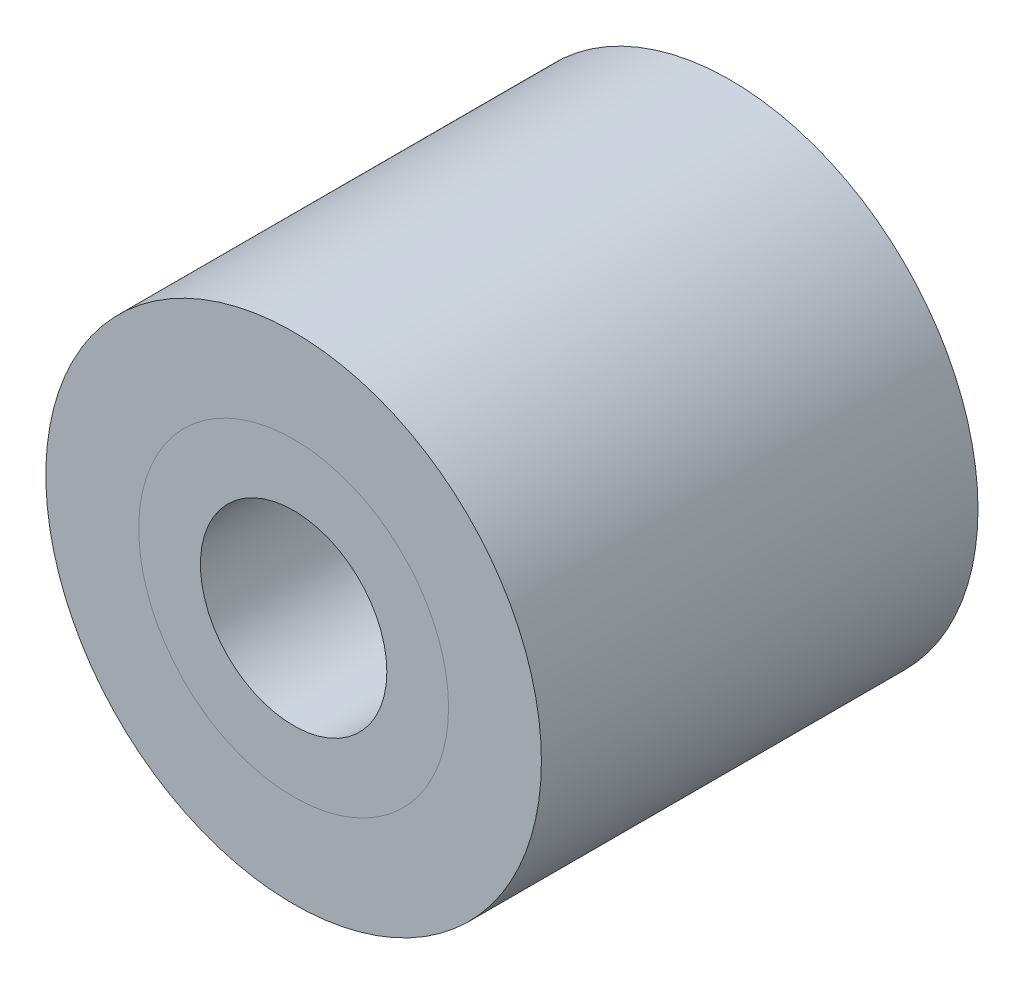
SolidWorks part; units mm, degrees
ref_plane "正面" through (0, 0, 0) normal (0, 0, 1) x (1, 0, 0)
ref_plane "平面" through (0, 0, 0) normal (0, 1, 0) x (1, 0, 0)
ref_plane "右側面" through (0, 0, 0) normal (1, 0, 0) x (0, 0, -1)
sketch "ｽｹｯﾁ1" plane through (0, 0, 0) normal (0, 0, 1) x (1, 0, 0)
  circle A0 centre (0, 0) radius 21
  dimension "D1" = 42
extrude "ﾎﾞｽ - 押し出し1" add sketch "ｽｹｯﾁ1" against normal blind 37
sketch "ｽｹｯﾁ2" plane through (0, 0, 0) normal (0, 0, 1) x (1, 0, 0)
  circle A0 centre (0, 0) radius 7.9
  dimension "D1" = 15.8
extrude "ｶｯﾄ - 押し出し1" cut sketch "ｽｹｯﾁ2" against normal through all
sketch "s-基準円直径" plane through (0, 0, 0) normal (0, 0, 1) x (1, 0, 0)
  circle A0 centre (0, 0) radius 17.5 construction
  dimension "D1" = 35
sketch "s-基準円直径側面" plane through (0, 0, 0) normal (1, 0, 0) x (0, 0, -1)
  line L1 (37, -21) -> (37, 21) construction
  line L2 (0, 17.5) -> (37, 17.5) construction
  line L4 (0, -17.5) -> (37, -17.5) construction
sketch "s-歯底円直径" plane through (0, 0, 0) normal (0, 0, 1) x (1, 0, 0)
  circle A0 centre (0, 0) radius 13.13
  circle A4 centre (0, 0) radius 21 construction
  dimension "D1" = 7.87
split "部品分割1" trim tools "s-歯底円直径" bodies to split 102 resulting bodies 103 104
sketch "ｽｹｯﾁ6" plane through (0, 0, 0) normal (0, 1, 0) x (1, 0, 0)
  line L0 (0, 0) -> (0, 18.5) construction
  line L1 (-21, 0) -> (21, 0) construction
  circle A0 centre (0, 18.5) radius 2
  dimension "D1" = 4
  dimension "D2" = 18.5
extrude "ｶｯﾄ - 押し出し2" cut sketch "ｽｹｯﾁ6" along normal through all
